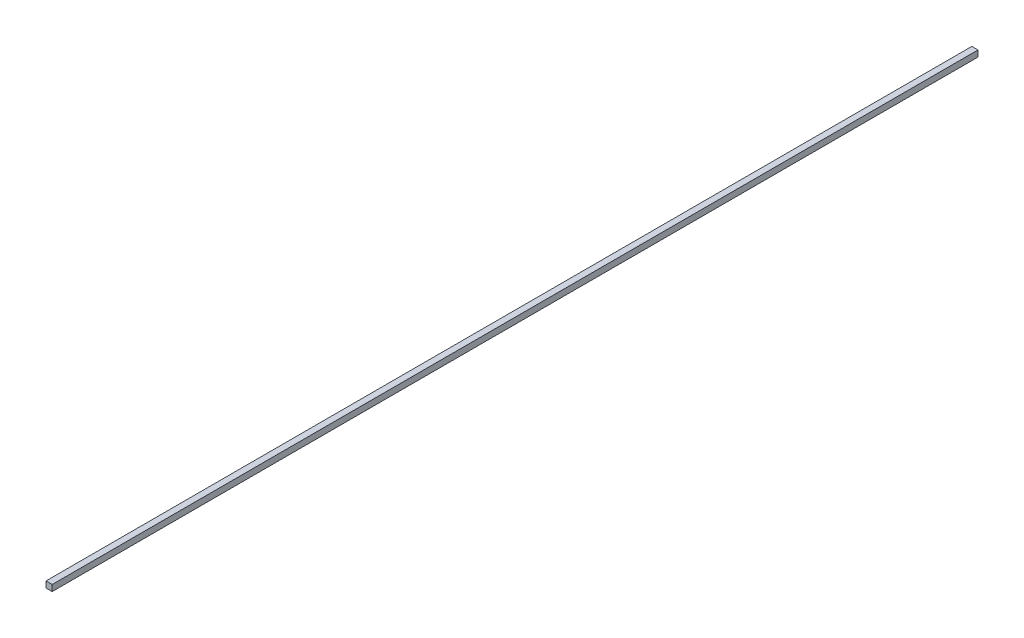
SolidWorks part; units mm, degrees
ref_plane "Plan de face" through (0, 0, 0) normal (0, 0, 1) x (1, 0, 0)
ref_plane "Plan de dessus" through (0, 0, 0) normal (0, 1, 0) x (1, 0, 0)
ref_plane "Plan de droite" through (0, 0, 0) normal (1, 0, 0) x (0, 0, -1)
sketch "Esquisse1" plane through (0, 0, 0) normal (0, 0, 1) x (1, 0, 0)
  line L1 (-1, 1) -> (1, 1)
  line L2 (-1, 1) -> (-1, -1)
  line L3 (-1, -1) -> (1, -1)
  line L4 (1, 1) -> (1, -1)
  point P4 (0, 1)
  point P5 (-1, 0)
  dimension "D1" = 2
  dimension "D2" = 2
extrude "Extrusion1" add sketch "Esquisse1" along normal mid plane 300
